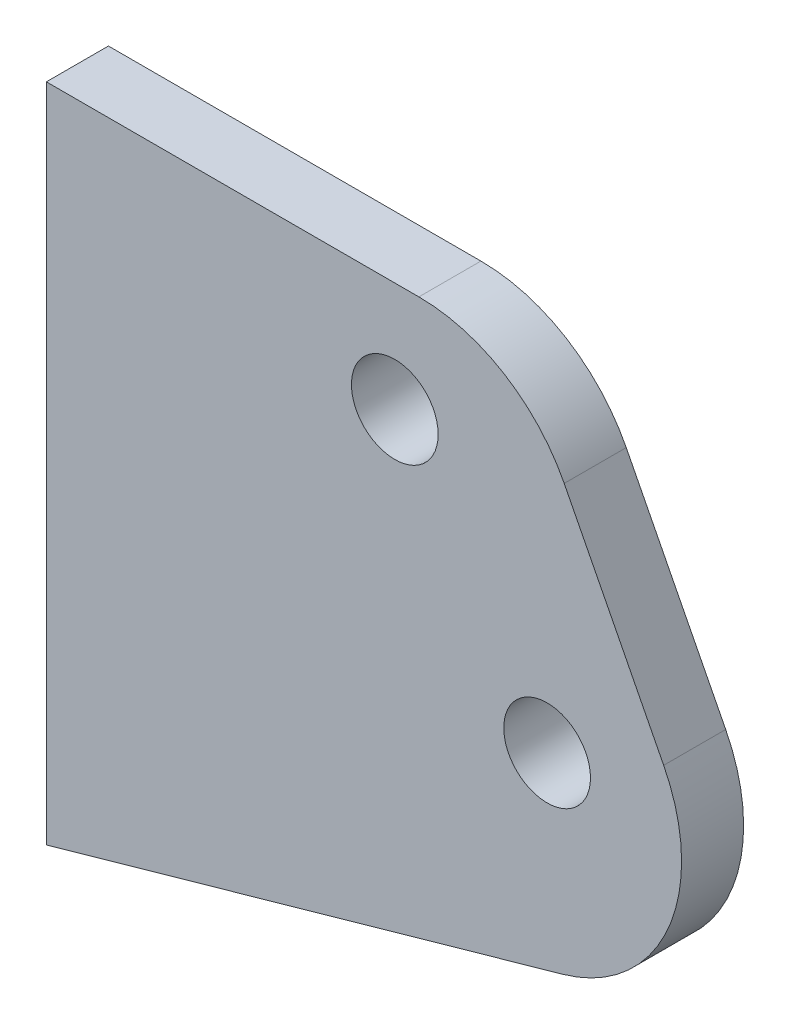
SolidWorks part; units mm, degrees
ref_plane "Front Plane" through (0, 0, 0) normal (0, 0, 1) x (1, 0, 0)
ref_plane "Top Plane" through (0, 0, 0) normal (0, 1, 0) x (1, 0, 0)
ref_plane "Right Plane" through (0, 0, 0) normal (1, 0, 0) x (0, 0, -1)
sketch "Sketch1" plane through (0, 0, 0) normal (0, 0, 1) x (1, 0, 0)
  line L0 (0, 0) -> (0, 51.418)
  line L1 (0, 51.418) -> (36.7485, 51.418)
  line L2 (36.7485, 51.418) -> (55.0793, 15.5924)
  line L3 (55.0793, 15.5924) -> (0, 0)
extrude "Boss-Extrude1" add sketch "Sketch1" along normal blind 4.826
sketch "Sketch2" plane through (0, 0, 4.826) normal (0, 0, 1) x (1, 0, 0)
  circle A0 centre (27.1062, 42.8977) radius 3.3731
  circle A1 centre (38.9577, 25.6832) radius 3.3731
  dimension "D2" = 20.8996
extrude "Cut-Extrude1" cut sketch "Sketch2" against normal through all
fillet "Fillet1" radius 12.7 2 edges at (55.0793, 15.5924, 2.413) (36.7485, 51.418, 2.413)
